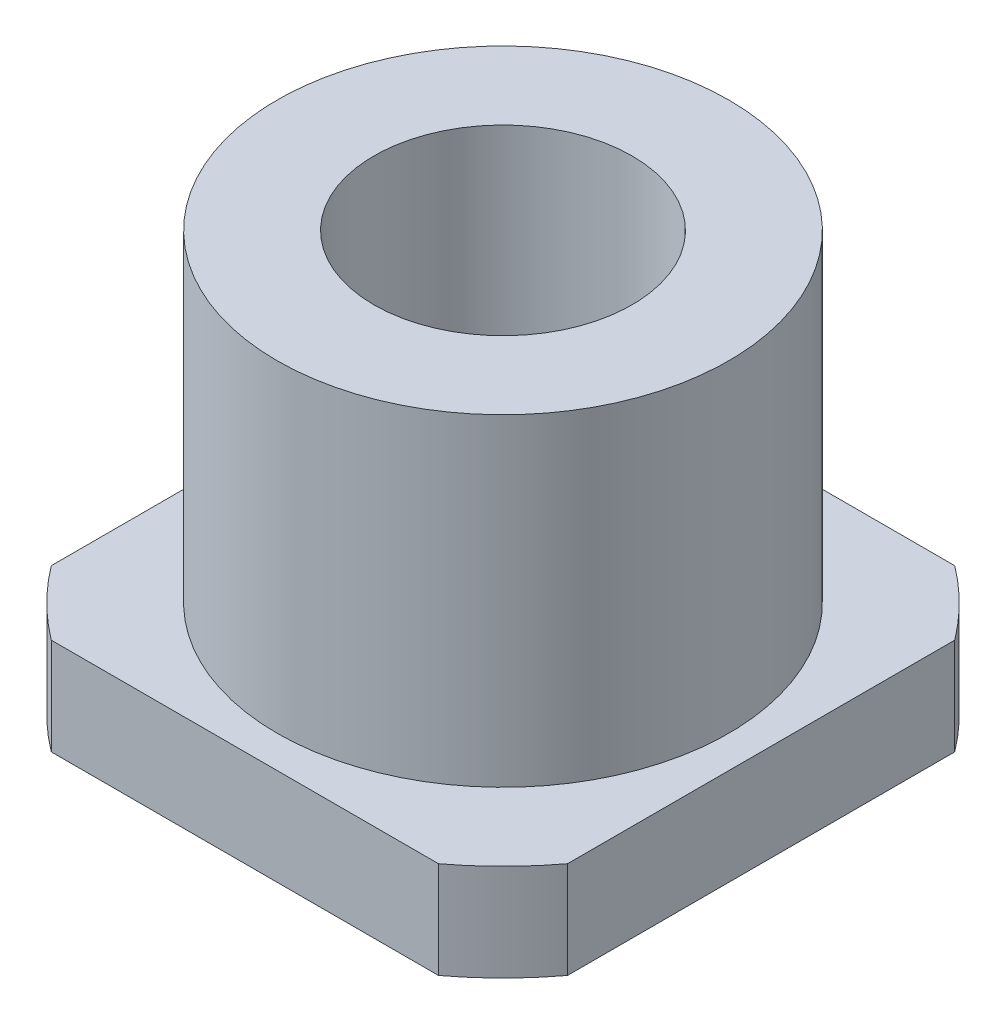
SolidWorks part; units mm, degrees
ref_plane "Front Plane" through (0, 0, 0) normal (0, 0, 1) x (1, 0, 0)
ref_plane "Top Plane" through (0, 0, 0) normal (0, 1, 0) x (1, 0, 0)
ref_plane "Right Plane" through (0, 0, 0) normal (1, 0, 0) x (0, 0, -1)
sketch "Sketch1" plane through (0, 0, 0) normal (0, 1, 0) x (1, 0, 0)
  circle A0 centre (0, 0) radius 4
  circle A1 centre (0, 0) radius 7
  dimension "D1" = 8
  dimension "D2" = 14
extrude "Boss-Extrude1" add sketch "Sketch1" along normal blind 10
sketch "Sketch2" plane through (0, 0, 0) normal (0, -1, 0) x (1, 0, 0)
  circle A0 centre (0, 0) radius 4
  circle A1 centre (0, 0) radius 10
  dimension "D1" = 20
extrude "Boss-Extrude2" add sketch "Sketch2" along normal blind 3
thread "Thread1" pitch 1.5 start angle 0, offset 3, length 20, pitch 1.25, diameter 8
ref_plane "Plane1" through (-4, 13, 0) normal (0, 0, 1) x (-1, 0, 0)
sketch "Thread Profile1" plane through (-4, 13, 0) normal (0, 0, 1) x (-1, 0, 0)
  line L0 (0, 0) -> (0, 1.5) construction
  line L1 (0, 0) -> (0.8119, 0.4687)
  line L2 (0.8119, 0.4687) -> (0.8119, 0.6562)
  line L3 (0.8119, 0.6562) -> (0, 1.125)
  line L4 (0.8119, 0.5625) -> (0, 0.5625) construction
  line L11 (0, 0) -> (0, 1.125)
  point P2 (0, 0)
  dimension "Pitch" = 1.5
  dimension "Profile_Angle" = 60
  dimension "Profile_Land" = 0.1875
  dimension "Profile_Height" = 0.8119
sketch "Sketch7" plane through (0, -3, 0) normal (0, -1, 0) x (1, 0, 0)
  line L1 (8, -8) -> (-8, -8)
  line L2 (8, -8) -> (8, 8)
  line L3 (8, 8) -> (-8, 8)
  line L4 (-8, -8) -> (-8, 8)
  line L5 (8, -8) -> (-8, 8) construction
  line L6 (8, 8) -> (-8, -8) construction
  line L7 (12.6668, 11.3893) -> (-12.6668, 11.3893)
  line L8 (12.6668, 11.3893) -> (12.6668, -11.3893)
  line L9 (12.6668, -11.3893) -> (-12.6668, -11.3893)
  line L10 (-12.6668, 11.3893) -> (-12.6668, -11.3893)
  line L11 (12.6668, 11.3893) -> (-12.6668, -11.3893) construction
  line L12 (12.6668, -11.3893) -> (-12.6668, 11.3893) construction
  point P0 (0, 0)
  point P6 (0, 0)
  dimension "D1" = 16
  dimension "D2" = 16
extrude "Cut-Extrude1" cut sketch "Sketch7" against normal blind 10
